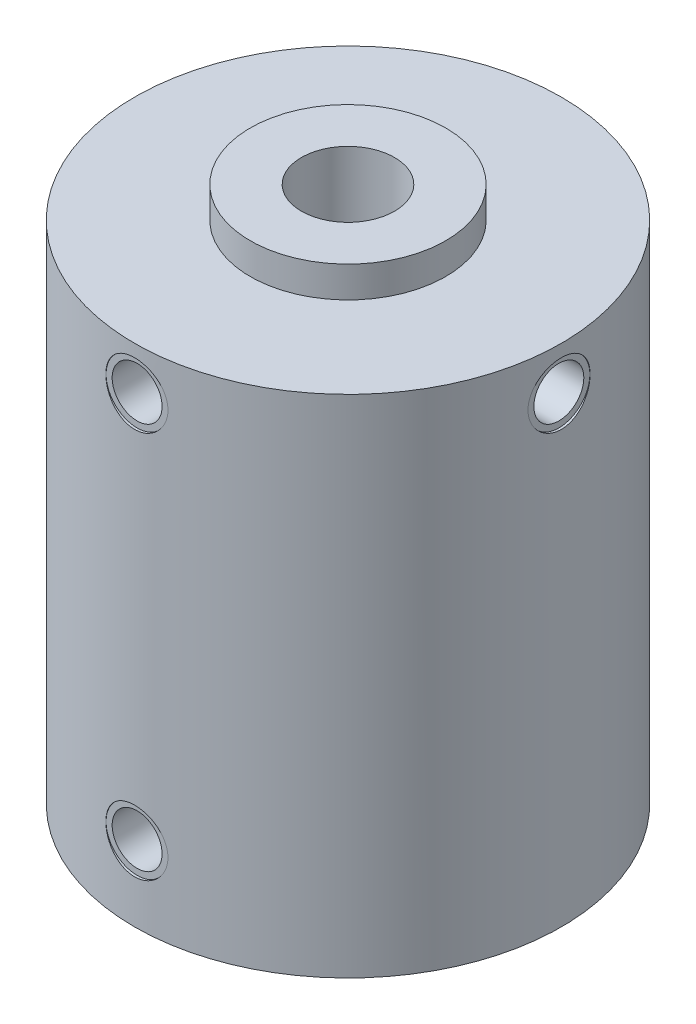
SolidWorks part; units mm, degrees
ref_plane "Front Plane" through (0, 0, 0) normal (0, 0, 1) x (1, 0, 0)
ref_plane "Top Plane" through (0, 0, 0) normal (0, 1, 0) x (1, 0, 0)
ref_plane "Right Plane" through (0, 0, 0) normal (1, 0, 0) x (0, 0, -1)
sketch "Sketch1" plane through (0, 0, 0) normal (0, 1, 0) x (1, 0, 0)
  circle A0 centre (0, 0) radius 21.8186
  dimension "D1" = 43.6372
extrude "Extrude1" add sketch "Sketch1" along normal blind 54.864
sketch "Sketch2" plane through (0, 54.864, 0) normal (0, 1, 0) x (-1, 0, 0)
  circle A0 centre (0, 0) radius 4.7625
  dimension "D1" = 9.525
extrude "Cut-Extrude1" cut sketch "Sketch2" against normal blind 20.828
sketch "Sketch3" plane through (0, 0, 0) normal (0, -1, 0) x (1, 0, 0)
  circle A0 centre (0, 0) radius 6.35
  dimension "D1" = 12.7
extrude "Cut-Extrude2" cut sketch "Sketch3" against normal blind 20.828
sketch "Sketch4" plane through (0, 54.864, 0) normal (0, -1, 0) x (1, 0, 0)
  circle A0 centre (0, 0) radius 9.9949
  circle A1 centre (0, 0) radius 22.225
  dimension "D1" = 19.9898
extrude "Cut-Extrude3" cut sketch "Sketch4" along normal blind 3.175
ref_plane "Plane1" through (0, 0, 6.35) normal (0, 0, 1) x (1, 0, 0)
sketch "Sketch5" plane through (0, 0, 6.35) normal (0, 0, 1) x (1, 0, 0)
  line L0 (-21.8186, 0) -> (21.8186, 0) construction
  line L1 (-1.5875, 0) -> (1.5875, 0)
  line L2 (-1.5875, 0) -> (-1.5875, 21.336)
  line L3 (-1.5875, 21.336) -> (1.5875, 21.336)
  line L4 (1.5875, 0) -> (1.5875, 21.336)
  dimension "D1" = 3.175
  dimension "D2" = 1.5875
  dimension "D3" = 21.336
extrude "Cut-Extrude5" cut sketch "Sketch5" along normal blind 1.5875 and the other way blind 2.54
ref_plane "Plane2" through (0, 0, 21.8186) normal (0, 0, 1) x (1, 0, 0)
sketch "Sketch6" plane through (0, 0, 21.8186) normal (0, 0, 1) x (1, 0, 0)
  line L0 (9.9949, 54.864) -> (-9.9949, 54.864) construction
  circle A0 centre (0, 47.244) radius 3.175
  dimension "D2" = 6.35
  dimension "D1" = 7.62
extrude "Cut-Extrude6" cut sketch "Sketch6" against normal blind 0.254
sketch "Sketch9" plane through (0, 0, 21.5646) normal (0, 0, 1) x (1, 0, 0)
  point P0 (0, 47.244)
hole_wizard "1/4-20 Tapped Hole1" positions "3DSketch3" profile "Sketch10" tap size "1/4-20" standard "Ansi Inch"
sketch3d "3DSketch3"
  point P0 (0, 47.244, 21.5646)
sketch "Sketch10" plane through (0, 47.244, 21.5646) normal (1, 0, 0) x (0, -1, 0)
  line L0 (0, 0) -> (0, 27.8609)
  line L1 (0, 27.8609) -> (2.5527, 26.3271)
  line L2 (2.5527, 26.3271) -> (2.5527, 0)
  line L5 (2.5527, 0) -> (0, 0)
  line L10 (0, 27.8609) -> (-2.5527, 26.3271) construction
  line L11 (0, -6.35) -> (0, 107.95) construction
  dimension "Tap Drill Dia." = 5.1054
  dimension "Tap Drill Depth" = 26.3271
  dimension "Drill Angle" = 118
ref_plane "Plane3" through (21.8186, 0, 0) normal (1, 0, 0) x (0, 0, -1)
sketch "Sketch13" plane through (21.8186, 0, 0) normal (1, 0, 0) x (0, 0, -1)
  line L0 (4.7625, 54.864) -> (-4.7625, 54.864) construction
  circle A0 centre (0, 47.244) radius 3.175
  dimension "D2" = 6.35
  dimension "D1" = 7.62
extrude "Cut-Extrude7" cut sketch "Sketch13" against normal blind 0.254
hole_wizard "1/4-20 Tapped Hole4" positions "3DSketch5" profile "Sketch14" tap size "1/4-20" standard "Ansi Inch"
sketch3d "3DSketch5"
  line L0 (21.5646, 47.244, 0) -> (21.5864, 47.244, 0) construction
  point P0 (21.5646, 47.244, 0)
sketch "Sketch14" plane through (21.5646, 47.244, 0) normal (0, 1, 0) x (0, 0, -1)
  line L0 (0, 0) -> (0, 16.8021)
  line L1 (0, 16.8021) -> (2.5527, 16.8021)
  line L2 (2.5527, 16.8021) -> (2.5527, 0)
  line L5 (2.5527, 0) -> (0, 0)
  line L11 (0, -6.35) -> (0, 107.95) construction
  dimension "Thru Tap Drill Dia." = 5.1054
  dimension "Thru Tap Drill Depth" = 16.8021
ref_plane "Plane4" through (0, 27.432, 0) normal (0, 1, 0) x (-1, 0, 0)
mirror "Mirror1" about plane through (0, 27.432, 0) normal (0, 1, 0) of "1/4-20 Tapped Hole1", "Cut-Extrude6"
